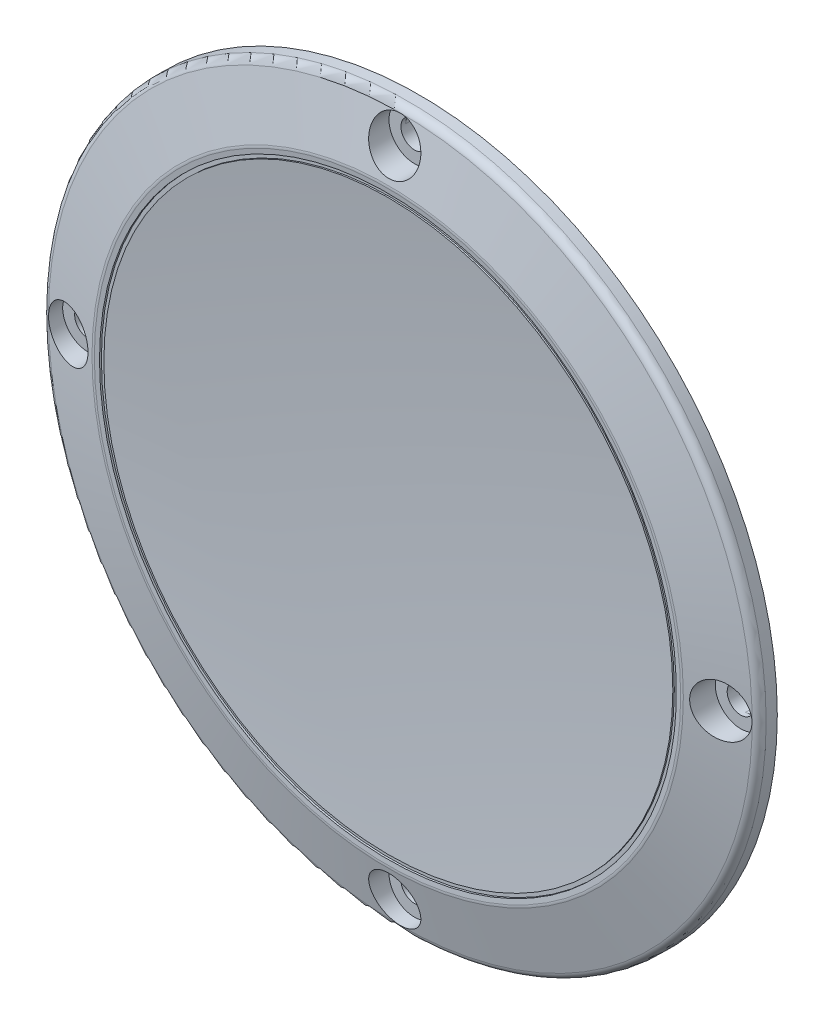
SolidWorks part; units mm, degrees
ref_plane "前视基准面" through (0, 0, 0) normal (0, 0, 1) x (1, 0, 0)
ref_plane "上视基准面" through (0, 0, 0) normal (0, 1, 0) x (1, 0, 0)
ref_plane "右视基准面" through (0, 0, 0) normal (1, 0, 0) x (0, 0, -1)
sketch "草图1" plane through (0, 0, 0) normal (0, 0, 1) x (1, 0, 0)
  circle A0 centre (0, 0) radius 45
  dimension "D1" = 90
extrude "凸台-拉伸1" add sketch "草图1" along normal blind 25
hole_wizard "打孔尺寸(%根据)内六角圆柱头螺钉的类型1" positions "草图2" profile "草图3" counterbore size "M3" standard "GB"
sketch "草图2" plane through (0, 0, 25) normal (0, 0, 1) x (1, 0, 0)
  line L0 (3.019, 0) -> (-3.019, 0) construction
  point P0 (41, 0)
  dimension "D1" = 41
sketch "草图3" plane through (41, 0, 25) normal (1, 0, 0) x (0, -1, 0)
  line L0 (0, 0) -> (0, 25)
  line L1 (0, 25) -> (1.7, 25)
  line L3 (1.7, 25) -> (1.7, 3.4)
  line L4 (1.7, 3.4) -> (3, 3.4)
  line L5 (3, 3.4) -> (3, 0)
  line L7 (3, 0) -> (0, 0)
  line L11 (0, -6.35) -> (0, 107.95) construction
  dimension "通孔孔直径" = 3.4
  dimension "通孔孔深度" = 25
  dimension "柱形沉头孔直径" = 6
  dimension "柱形沉头孔深度" = 3.4
pattern_circular "阵列(圆周)1" count 4 over 360 about axis through (0, 0, 0) along (0, 0, 1) of "打孔尺寸(%根据)内六角圆柱头螺钉的类型1"
sketch "草图4" plane through (0, 0, 0) normal (0, 0, -1) x (-1, 0, 0)
  circle A0 centre (0, 0) radius 42
  circle A1 centre (41, 0) radius 3.2
  circle A2 centre (0, 41) radius 3.2
  circle A3 centre (-41, 0) radius 3.2
  circle A4 centre (0, -41) radius 3.2
  dimension "D1" = 84
  dimension "D2" = 6.4
  dimension "D3" = 6.4
  dimension "D4" = 6.4
  dimension "D5" = 6.4
extrude "切除-拉伸1" cut sketch "草图4" against normal blind 21.5 contours A4 A0 A1 A2 A3
fillet "圆角6" radius 2 8 edges at (41.8873, -3.0745, 10.75) (41.8873, 3.0745, 10.75) (-3.0745, -41.8873, 10.75) (3.0745, -41.8873, 10.75) (-41.8873, 3.0745, 10.75) (-41.8873, -3.0745, 10.75) (3.0745, 41.8873, 10.75) (-3.0745, 41.8873, 10.75)
chamfer "倒角1" distance 1.8 distance2 8 1 edges at (45, 0, 25)
sketch "草图7" plane through (0, 0, 0) normal (0, 1, 0) x (1, 0, 0)
  line L0 (0, -25) -> (37, -25)
  line L1 (-37, -25) -> (37, -25) construction
  line L2 (0, -25) -> (-37, -25)
  line L3 (0, -25) -> (0, -23.2) construction
  line L4 (0, -3.019) -> (0, 3.019) construction
  arc A0 (-37, -25) -> (37, -25) centre (0, -404.3778) cw
  dimension "D1" = 37
  dimension "D2" = 37
  dimension "D3" = 1.8
revolve "切除-旋转1" cut sketch "草图7" angle 360 about L3
fillet "圆角3" radius 1 2 edges at (45, 0, 23.2) (37, 0, 25)
sketch "草图5" plane through (0, 0, 0) normal (0, 0, -1) x (-1, 0, 0)
  circle A0 centre (0, 0) radius 43
  dimension "D1" = 86
extrude "切除-拉伸2" cut sketch "草图5" against normal blind 4 flip side to cut
sketch "草图6" plane through (0, 0, 4) normal (0, 0, -1) x (-1, 0, 0)
  circle A2 centre (0, 0) radius 44.9
  circle A3 centre (0, 0) radius 44.9
  dimension "D1" = 0.1
extrude "切除-拉伸4" cut sketch "草图6" against normal blind 4 flip side to cut
chamfer "倒角3" distance 0.5 angle 45 1 edges at (-44.9, 0, 4)
sketch "草图8" plane through (0, 0, 0) normal (0, 0, -1) x (-1, 0, 0)
  line L0 (0, 41) -> (0, 47.7432) construction
  line L1 (0, 3.019) -> (0, -3.019) construction
  line L2 (-1.7, 41) -> (-1.7, 47.7432)
  line L3 (1.7, 41) -> (1.7, 47.7432)
  arc A0 (-1.7, 41) -> (1.7, 41) centre (0, 41) ccw
  arc A1 (1.7, 47.7432) -> (-1.7, 47.7432) centre (0, 47.7432) ccw
  circle A2 centre (0, 41) radius 1.7 construction
  point P6 (0, 44.3716)
extrude "切除-拉伸5" cut sketch "草图8" against normal up to surface (4 mm away)
pattern_circular "阵列(圆周)2" count 4 over 360 about axis through (0, 0, 0) along (0, 0, 1) of "切除-拉伸5"
chamfer "倒角5" distance 0.1 angle 45 1 edges at (-45, 0, 8)
other "删除面1"
other "移动面1" parameters "D1"=17.5
other "移动面2" parameters "D1"=19.5
sketch "草图9" plane through (0, 0, 21.5) normal (0, 0, -1) x (-1, 0, 0)
  circle A0 centre (0, 0) radius 34.4
  dimension "D1" = 68.8
extrude "切除-拉伸6" cut sketch "草图9" against normal blind 0.5
other "移动面3" parameters "D1"=0.5
ref_plane "基准面1" through (0, 0, 24.99) normal (0, 0, -1) x (-1, 0, 0)
sketch "草图11" plane through (0, 0, 24.99) normal (0, 0, -1) x (-1, 0, 0)
  circle A0 centre (0, 0) radius 36.25
  circle A1 centre (0, 0) radius 35.75
  circle A2 centre (0, 0) radius 36.8404
  dimension "D1" = 72.5
  dimension "D3" = 73.6809
  dimension "D2" = 0.5
extrude "切除-拉伸7" cut sketch "草图11" along normal blind 0.3 contours A0 A1
fillet "圆角8" radius 0.5 16 edges at (3.9105, 41.3396, 21.5) (0, 37.8, 21.5) (-3.9105, 41.3396, 21.5) (-29.6985, 29.6985, 21.5) (-41.3396, 3.9105, 21.5) (-37.8, 0, 21.5) (-41.3396, -3.9105, 21.5) (-29.6985, -29.6985, 21.5) (-3.9105, -41.3396, 21.5) (0, -37.8, 21.5) (3.9105, -41.3396, 21.5) (29.6985, -29.6985, 21.5) (41.3396, -3.9105, 21.5) (37.8, 0, 21.5) (41.3396, 3.9105, 21.5) (29.6985, 29.6985, 21.5)
sketch "草图12" plane through (0, 0, 21.6) normal (0, 0, 1) x (1, 0, 0)
  circle A0 centre (0, 41) radius 3.2
  circle A1 centre (-41, 0) radius 3.2
  circle A2 centre (41, 0) radius 3.2
  circle A3 centre (0, -41) radius 3.2
extrude "切除-拉伸8" cut sketch "草图12" along normal blind 10
other "移动面4" parameters "D1"=0.2
fillet "圆角7" radius 1 8 edges at (-1.7, 42.7662, 20.25) (1.7, 42.7662, 20.25) (-42.7662, -1.7, 20.25) (-42.7662, 1.7, 20.25) (-1.7, -42.7662, 20.25) (1.7, -42.7662, 20.25) (42.7662, -1.7, 20.25) (42.7662, 1.7, 20.25)
